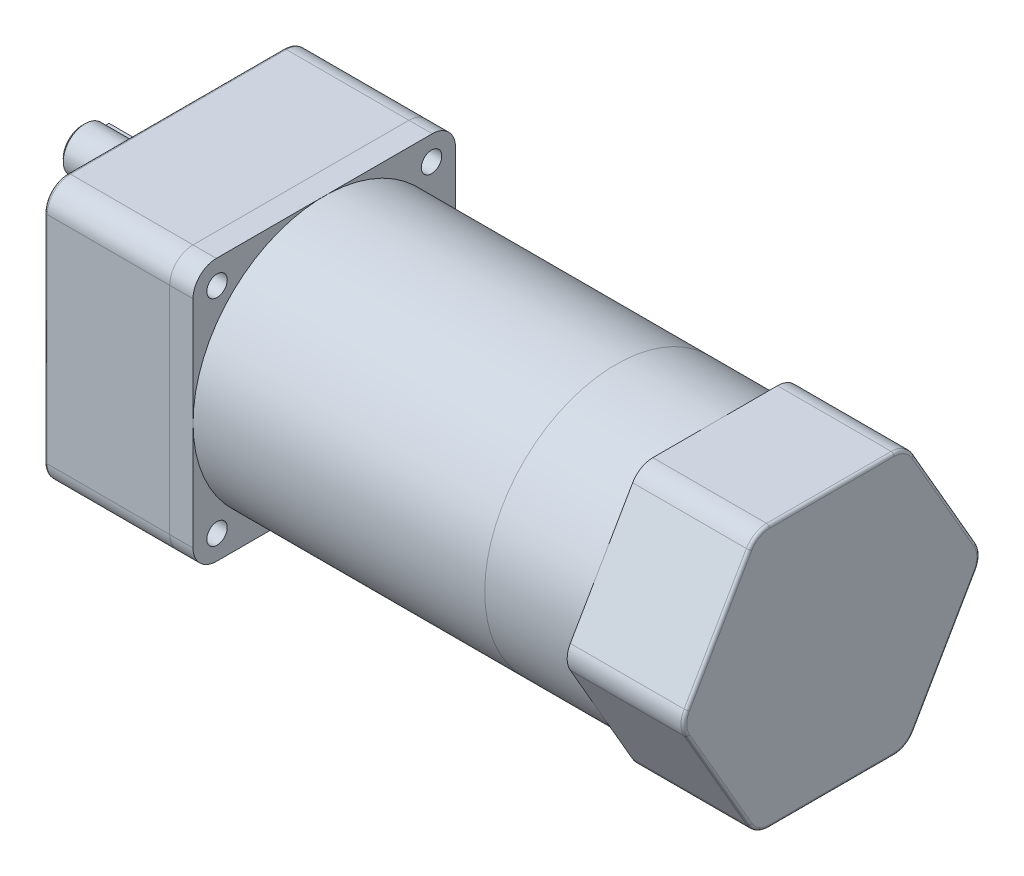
SolidWorks part; units mm, degrees
ref_plane "前视基准面" through (0, 0, 0) normal (0, 0, 1) x (1, 0, 0)
ref_plane "上视基准面" through (0, 0, 0) normal (0, 1, 0) x (1, 0, 0)
ref_plane "右视基准面" through (0, 0, 0) normal (1, 0, 0) x (0, 0, -1)
sketch "草图1" plane through (0, 0, 0) normal (1, 0, 0) x (0, 0, -1)
  line L1 (-37, -45) -> (37, -45)
  line L2 (-45, -37) -> (-45, 37)
  line L3 (-37, 45) -> (37, 45)
  line L4 (45, -37) -> (45, 37)
  line L5 (-45, -45) -> (45, 45) construction
  line L6 (-45, 45) -> (45, -45) construction
  arc A0 (-37, -45) -> (-45, -37) centre (-37, -37) cw
  arc A1 (-45, 37) -> (-37, 45) centre (-37, 37) cw
  arc A2 (37, 45) -> (45, 37) centre (37, 37) cw
  arc A3 (37, -45) -> (45, -37) centre (37, -37) ccw
  point P0 (0, 0)
  dimension "D1" = 8
extrude "凸台-拉伸1" add sketch "草图1" along normal blind 43
sketch "草图2" plane through (43, 0, 0) normal (1, 0, 0) x (0, 0, -1)
  line L0 (37, 45) -> (-37, 45) construction
  line L1 (-37, -45) -> (37, -45)
  line L2 (-45, -37) -> (-45, 37)
  line L3 (-37, 45) -> (37, 45)
  line L4 (45, -37) -> (45, 37)
  line L5 (-45, -45) -> (45, 45) construction
  line L6 (-45, 45) -> (45, -45) construction
  arc A0 (37, 45) -> (45, 37) centre (37, 37) cw
  arc A1 (37, -45) -> (45, -37) centre (37, -37) ccw
  arc A2 (-37, -45) -> (-45, -37) centre (-37, -37) cw
  arc A3 (-45, 37) -> (-37, 45) centre (-37, 37) cw
  point P0 (0, 0)
  dimension "D1" = 8
extrude "凸台-拉伸2" add sketch "草图2" along normal blind 8 separate body
sketch "草图3" plane through (51, 0, 0) normal (1, 0, 0) x (0, 0, -1)
  circle A0 centre (0, 0) radius 45
extrude "凸台-拉伸3" add sketch "草图3" along normal blind 100 separate body
sketch "草图4" plane through (151, 0, 0) normal (1, 0, 0) x (0, 0, -1)
  circle A0 centre (0, 0) radius 45
extrude "凸台-拉伸4" add sketch "草图4" along normal blind 34 separate body
sketch "草图5" plane through (185, 0, 0) normal (1, 0, 0) x (0, 0, -1)
  line L1 (21.362, 45) -> (-21.362, 45)
  line L2 (-28.2902, 41) -> (-49.6521, 4)
  line L3 (-49.6521, -4) -> (-28.2902, -41)
  line L4 (-21.362, -45) -> (21.362, -45)
  line L5 (28.2902, -41) -> (49.6521, -4)
  line L6 (49.6521, 4) -> (28.2902, 41)
  circle A0 centre (0, 0) radius 45 construction
  arc A1 (-49.6521, 4) -> (-49.6521, -4) centre (-42.7239, 0) ccw
  arc A2 (-28.2902, -41) -> (-21.362, -45) centre (-21.362, -37) ccw
  arc A3 (21.362, -45) -> (28.2902, -41) centre (21.362, -37) ccw
  arc A4 (49.6521, -4) -> (49.6521, 4) centre (42.7239, 0) ccw
  arc A5 (21.362, 45) -> (28.2902, 41) centre (21.362, 37) cw
  arc A6 (-21.362, 45) -> (-28.2902, 41) centre (-21.362, 37) ccw
  dimension "D1" = 8
extrude "凸台-拉伸5" add sketch "草图5" along normal blind 40 separate body
fillet "圆角1" radius 1 12 edges at (225, 22.5, 38.9711) (225, 43.9282, 25.362) (225, 45, 0) (225, 43.9282, -25.362) (225, 22.5, -38.9711) (225, 0, -50.7239) (225, -22.5, -38.9711) (225, -43.9282, -25.362) (225, -45, 0) (225, -43.9282, 25.362) (225, -22.5, 38.9711) (225, 0, 50.7239)
fillet "圆角2" radius 1 8 edges at (0, -45, 0) (0, -42.6569, -42.6569) (0, 0, -45) (0, 42.6569, -42.6569) (0, 45, 0) (0, 42.6569, 42.6569) (0, 0, 45) (0, -42.6569, 42.6569)
sketch "草图6" plane through (0, 0, 0) normal (-1, 0, 0) x (0, 0, 1)
  point P19 (36.7696, 36.7696)
  point P20 (36.7696, -36.7696)
  point P21 (-36.7696, -36.7696)
  point P22 (-36.7696, 36.7696)
hole_wizard "M6 螺纹孔1" positions "3D草图1" profile "草图7" tap size "M6" standard "GB"
sketch3d "3D草图1"
  point P0 (0, 36.7696, 36.7696)
  point P3 (0, -36.7696, 36.7696)
  point P6 (0, 36.7696, -36.7696)
  point P9 (0, -36.7696, -36.7696)
sketch "草图7" plane through (0, 36.7696, 36.7696) normal (0, 1, 0) x (0, 0, 1)
  line L0 (0, 0) -> (0, 18.5022)
  line L1 (0, 18.5022) -> (2.5, 17)
  line L2 (2.5, 17) -> (2.5, 0)
  line L5 (2.5, 0) -> (0, 0)
  line L10 (0, 18.5022) -> (-2.5, 17) construction
  line L11 (0, -6.35) -> (0, 107.95) construction
  dimension "螺纹孔钻头直径" = 5
  dimension "螺纹孔钻头深度" = 17
  dimension "导头角度" = 118
sketch "草图8" plane through (51, 0, 0) normal (1, 0, 0) x (0, 0, -1)
  line L1 (42.6569, -42.6569) -> (42.6569, 42.6569)
  arc A2 (37, -45) -> (45, -37) centre (37, -37) ccw construction
  arc A3 (45, 37) -> (37, 45) centre (37, 37) ccw construction
  circle A5 centre (-36.7696, 36.7696) radius 3.5
  circle A6 centre (36.7696, 36.7696) radius 3.5
  circle A7 centre (36.7696, -36.7696) radius 3.5
  circle A8 centre (-36.7696, -36.7696) radius 3.5
extrude "切除-拉伸1" cut sketch "草图8" against normal blind 26 contours A5 | A6 | A7 | A8
sketch "草图9" plane through (0, 0, 0) normal (-1, 0, 0) x (0, 0, 1)
  circle A0 centre (0, 18) radius 16
extrude "凸台-拉伸6" add sketch "草图9" along normal blind 3
fillet "圆角3" radius 0.5 1 edges at (-3, 18, 16)
sketch "草图10" plane through (0, 0, 0) normal (-1, 0, 0) x (0, 0, 1)
  circle A0 centre (0, 0) radius 41.4
extrude "切除-拉伸2" cut sketch "草图10" against normal blind 0.5
fillet "圆角4" radius 0.5 1 edges at (0, 0, 41.4)
sketch "草图11" plane through (-3, 0, 0) normal (-1, 0, 0) x (0, 0, 1)
  circle A0 centre (0, 18) radius 7.5
extrude "凸台-拉伸7" add sketch "草图11" along normal blind 29 separate body
ref_plane "基准面1" through (0, 0, -7.5) normal (0, 0, 1) x (1, 0, 0)
sketch "草图12" plane through (0, 0, -7.5) normal (0, 0, 1) x (1, 0, 0)
  line L1 (-32, 25.5) -> (-32, 10.5) construction
  line L2 (-9.5, 20.5) -> (-32, 20.5)
  line L3 (-32, 20.5) -> (-32, 15.5)
  line L4 (-32, 15.5) -> (-9.5, 15.5)
  arc A0 (-9.5, 15.5) -> (-9.5, 20.5) centre (-9.5, 18) ccw
extrude "切除-拉伸4" cut sketch "草图12" along normal blind 3
sketch "草图13" plane through (0, 0, -4.5) normal (0, 0, -1) x (-1, 0, 0)
  line L0 (9.5, 20.5) -> (32, 20.5)
  line L1 (32, 20.5) -> (32, 15.5)
  line L2 (32, 15.5) -> (9.5, 15.5)
  arc A0 (9.5, 20.5) -> (9.5, 15.5) centre (9.5, 18) ccw
extrude "凸台-拉伸8" add sketch "草图13" along normal blind 5 separate body
chamfer "倒角1" distance 0.3 angle 45 4 edges at (-7, 18, -9.5) (-20.75, 15.5, -9.5) (-32, 18, -9.5) (-20.75, 20.5, -9.5)
chamfer "倒角2" distance 1 angle 45 1 edges at (-32, 18, 7.5)
